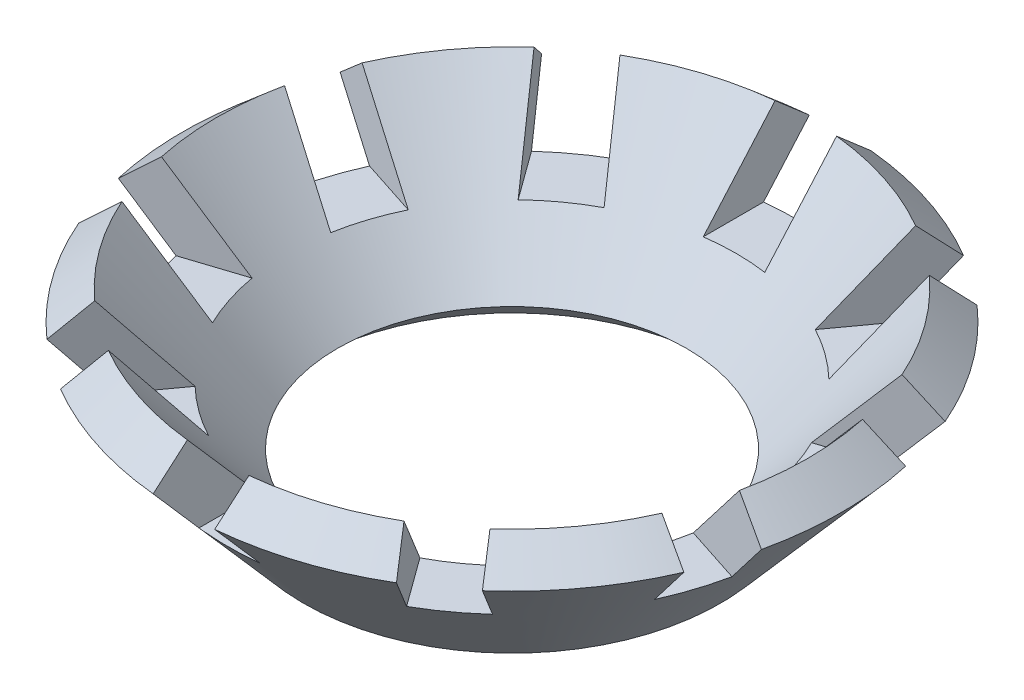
SolidWorks part; units mm, degrees
ref_plane "Спереди" through (0, 0, 0) normal (0, 0, 1) x (1, 0, 0)
ref_plane "Сверху" through (0, 0, 0) normal (0, 1, 0) x (1, 0, 0)
ref_plane "Справа" through (0, 0, 0) normal (1, 0, 0) x (0, 0, -1)
sketch "Эскиз1" plane through (0, 0, 0) normal (1, 0, 0) x (0, 0, -1)
  line L0 (0, -11.6874) -> (0, 2.895) construction
  line L1 (2.159, -1.7253) -> (2.5807, -2.0919)
  line L2 (2.5807, -2.0919) -> (4.0805, -0.3666)
  line L3 (4.0805, -0.3666) -> (3.6588, 0)
  line L4 (3.6588, 0) -> (2.159, -1.7253)
  dimension "D1" = 41
  dimension "D2" = 0.5588
  dimension "D3" = 2.286
  dimension "D4" = 4.318
revolve "Повернуть1" add sketch "Эскиз1" angle 360 about L0
sketch "Эскиз2" plane through (0, 0, 0) normal (0, 0, 1) x (1, 0, 0)
  line L1 (0.381, 0) -> (-0.381, 0)
  line L2 (0.381, 0) -> (0.381, -1.016)
  line L3 (0.381, -1.016) -> (-0.381, -1.016)
  line L4 (-0.381, 0) -> (-0.381, -1.016)
  dimension "D1" = 0.762
  dimension "D2" = 1.016
extrude "Вырез-Вытянуть1" cut sketch "Эскиз2" against normal through all
pattern_circular "Круговой массив1" count 10 over 360 about axis through (0, 0, 0) along (0, 1, 0) of "Вырез-Вытянуть1"
